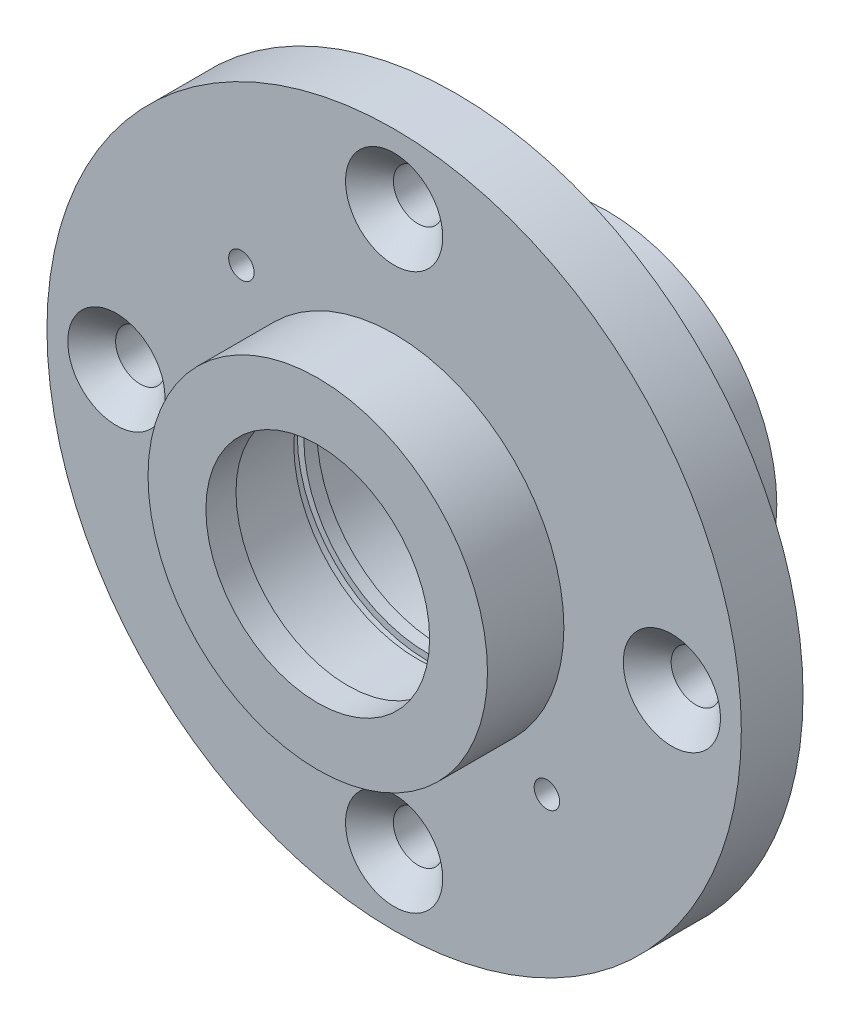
SolidWorks part; units mm, degrees
ref_plane "Przednia" through (0, 0, 0) normal (0, 0, 1) x (1, 0, 0)
ref_plane "Górna" through (0, 0, 0) normal (0, 1, 0) x (1, 0, 0)
ref_plane "Prawa" through (0, 0, 0) normal (1, 0, 0) x (0, 0, -1)
sketch "Szkic1" plane through (0, 0, 0) normal (0, 0, 1) x (1, 0, 0)
  circle A0 centre (0, 0) radius 22
  circle A1 centre (0, 0) radius 14.5
  dimension "D1" = 44
  dimension "D2" = 29
extrude "Dodanie-wyciągnięcie1" add sketch "Szkic1" along normal blind 37.5
ref_plane "Płaszczyzna1" through (0, 0, 19.6) normal (0, 0, 1) x (1, 0, 0)
sketch "Szkic2" plane through (0, 0, 19.6) normal (0, 0, 1) x (1, 0, 0)
  circle A0 centre (0, 0) radius 22
  circle A1 centre (0, 0) radius 45
  circle A2 centre (0, 0) radius 22 construction
  dimension "D1" = 90
extrude "Dodanie-wyciągnięcie2" add sketch "Szkic2" along normal blind 8
hole_wizard "Pogłębienie stożkowe pod M6 wkręt do części metalowych z łbem soczewkowym1" positions "Szkic4" profile "Szkic3" countersink size "M6" standard "Ansi Metric"
sketch "Szkic4" plane through (0, 0, 27.6) normal (0, 0, 1) x (1, 0, 0)
  line L0 (-36, 0) -> (0, 0) construction
  point P0 (-36, 0)
  point P13 (0, 36)
  point P14 (36, 0)
  point P15 (0, -36)
  dimension "D1" = 36
  dimension "D2" = 4
sketch "Szkic3" plane through (-36, 0, 27.6) normal (1, 0, 0) x (0, -1, 0)
  line L0 (0, 0) -> (0, 8)
  line L1 (0, 8) -> (3.2, 8)
  line L2 (3.2, 8) -> (3.2, 3.1)
  line L3 (3.2, 3.1) -> (6.3, 0)
  line L5 (6.3, 0) -> (0, 0)
  line L6 (-3.2, 3.1) -> (-6.3, 0) construction
  line L11 (0, -6.35) -> (0, 107.95) construction
  dimension "Średnica otworu na wylot" = 6.4
  dimension "Głębokość otworu na wylot" = 8
  dimension "Średnica zewnętrznego pogłębienia stożkowego" = 12.6
  dimension "Kąt zewnętrznego pogłębienia stożkowego" = 90
ref_plane "Płaszczyzna2" through (0, 0, 14.6) normal (0, 0, 1) x (1, 0, 0)
hole_wizard "Otwór gwintowany M4x0.71" positions "Szkic11" profile "Szkic10" tap size "M4x0.7" standard "Ansi Metric"
sketch "Szkic11" plane through (0, 0, 37.5) normal (0, 0, 1) x (1, 0, 0)
  line L0 (-19.799, 19.799) -> (0, 0) construction
  line L1 (0, 0) -> (19.799, -19.799) construction
  line L3 (0, 0) -> (-19.6651, 0)
  point P0 (-19.799, 19.799)
  point P2 (19.799, -19.799)
  dimension "D1" = 45
  dimension "D2" = 56
sketch "Szkic10" plane through (-19.799, 19.799, 37.5) normal (1, 0, 0) x (0, -1, 0)
  line L0 (0, 0) -> (0, 17.9)
  line L1 (0, 17.9) -> (1.65, 17.9)
  line L2 (1.65, 17.9) -> (1.65, 0)
  line L5 (1.65, 0) -> (0, 0)
  line L11 (0, -6.35) -> (0, 107.95) construction
  dimension "Średnica otworu gwintowanego na wylot" = 3.3
  dimension "Głębokość otworu gwintowanego na wylot" = 17.9
sketch "Szkic12" plane through (0, 0, 0) normal (0, 0, -1) x (-1, 0, 0)
  circle A0 centre (0, 0) radius 17.5
  dimension "D1" = 35
extrude "Wytnij-wyciągnięcie1" cut sketch "Szkic12" against normal offset from surface (14.6 mm away) 5
sketch "Szkic13" plane through (0, 0, 14.6) normal (0, 0, -1) x (-1, 0, 0)
  circle A0 centre (0, 0) radius 16
  dimension "D1" = 32
extrude "Wytnij-wyciągnięcie2" cut sketch "Szkic13" against normal blind 19
sketch "Szkic14" plane through (0, 0, 0) normal (0, 1, 0) x (1, 0, 0)
  line L0 (-17.5, 0) -> (-17.5, -14.6) construction
  line L1 (-17.5, -3) -> (-18.5, -3)
  line L2 (-17.5, -3) -> (-17.5, -4.6)
  line L3 (-17.5, -4.6) -> (-18.5, -4.6)
  line L4 (-18.5, -3) -> (-18.5, -4.6)
  line L5 (-16, -14.6) -> (-16, -33.6) construction
  line L6 (-16, -23.3) -> (-16.85, -23.3)
  line L7 (-16, -23.3) -> (-16, -24.6)
  line L8 (-16, -24.6) -> (-16.85, -24.6)
  line L9 (-16.85, -23.3) -> (-16.85, -24.6)
  line L10 (16, -14.6) -> (-16, -14.6) construction
  line L11 (16, -33.6) -> (-16, -33.6) construction
  line L12 (0, 0) -> (0, -11.6513) construction
  dimension "D1" = 1
  dimension "D2" = 1.6
  dimension "D3" = 1.3
  dimension "D4" = 0.85
  dimension "D5" = 10
  dimension "D6" = 9
revolve "Wycięcie-obrót1" cut sketch "Szkic14" angle 360 about L12
sketch "Szkic15" plane through (0, 0, 14.6) normal (0, 0, -1) x (-1, 0, 0)
  circle A0 centre (0, 0) radius 16.25
  dimension "D1" = 32.5
extrude "Wytnij-wyciągnięcie3" cut sketch "Szkic15" against normal blind 7
